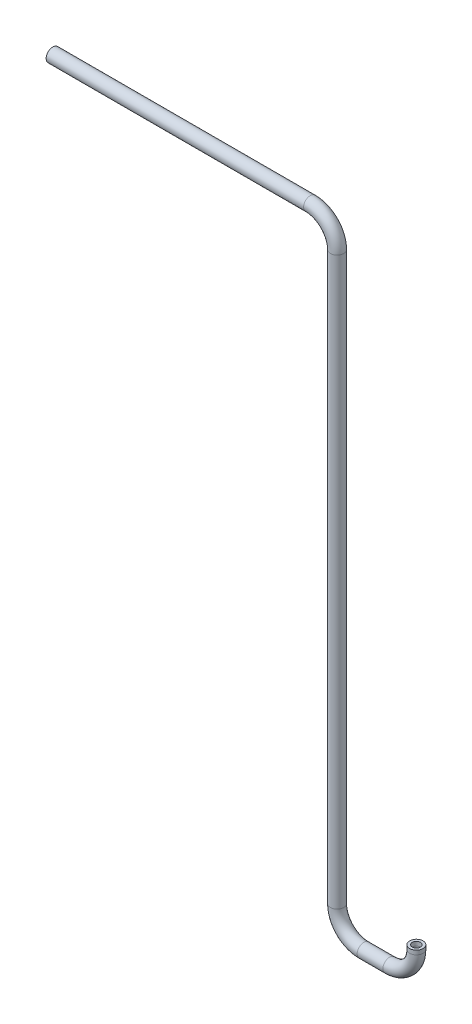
SolidWorks part; units mm, degrees
ref_plane "Plan de face" through (0, 0, 0) normal (0, 0, 1) x (1, 0, 0)
ref_plane "Plan de dessus" through (0, 0, 0) normal (0, 1, 0) x (1, 0, 0)
ref_plane "Plan de droite" through (0, 0, 0) normal (1, 0, 0) x (0, 0, -1)
sketch "Esquisse1" plane through (0, 0, 0) normal (0, 0, 1) x (1, 0, 0)
  line L0 (-25, 76) -> (-25, 626)
  line L1 (1, 50) -> (26, 50)
  line L2 (52, 76) -> (52, 80)
  line L3 (-51, 652) -> (-301, 652)
  arc A0 (26, 50) -> (52, 76) centre (26, 76) ccw
  arc A1 (-25, 626) -> (-51, 652) centre (-51, 626) ccw
  arc A2 (1, 50) -> (-25, 76) centre (1, 76) cw
  point P6 (52, 50)
  point P10 (-25, 652)
  point P13 (-25, 50)
  dimension "D1" = 26
  dimension "D4" = 25
  dimension "D6" = 26
  dimension "D2" = 250
  dimension "D3" = 30
  dimension "D5" = 550
other "Tube circulaire 1.4 POUCE - 8-13(1)"
ref_plane "Plan1" through (1, 50, 0) normal (1, 0, 0) x (0, 1, 0)
sketch "Esquisse11" plane through (1, 50, 0) normal (1, 0, 0) x (0, 1, 0)
  circle A0 centre (0, 0) radius 6.5
  circle A1 centre (0, 0) radius 4
  point P4 (0, 0)
  dimension "D1" = 13
  dimension "D2" = 8
